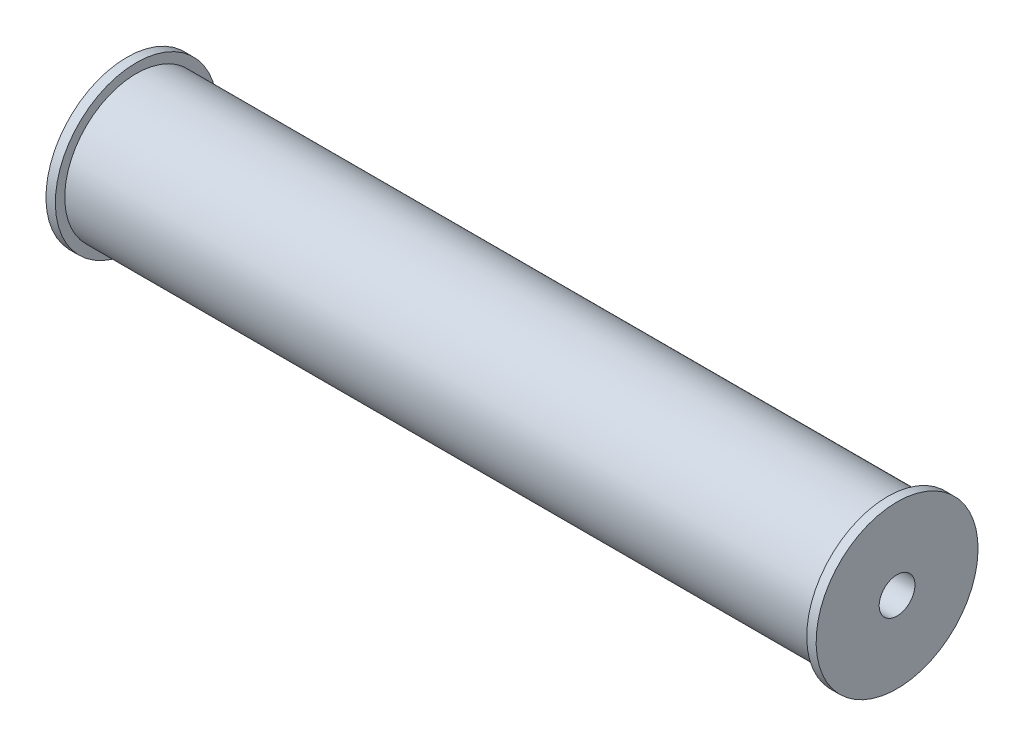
SolidWorks part; units mm, degrees
ref_plane "Front Plane" through (0, 0, 0) normal (0, 0, 1) x (1, 0, 0)
ref_plane "Top Plane" through (0, 0, 0) normal (0, 1, 0) x (1, 0, 0)
ref_plane "Right Plane" through (0, 0, 0) normal (1, 0, 0) x (0, 0, -1)
sketch "Sketch1" plane through (3359.6119, -126.9991, 62.9707) normal (-1, 0, 0) x (0, 0, -1)
  circle A0 centre (1.8793, 46.4927) radius 4.445 construction
  circle A1 centre (1.8793, 46.4927) radius 4.445 construction
  circle A2 centre (1.8793, 46.4927) radius 19.05
  circle A3 centre (1.8793, 46.4927) radius 4.7625
  dimension "D1" = 38.1
  dimension "D2" = 9.525
extrude "Boss-Extrude1" add sketch "Sketch1" along normal blind 205 contours A2 | A3
sketch "Sketch2" plane through (3359.6119, 0, 0) normal (1, 0, 0) x (0, 0, -1)
  circle A0 centre (-61.0914, -173.4918) radius 19.05 construction
  circle A1 centre (-61.0914, -173.4918) radius 19.05
  circle A2 centre (-61.0914, -173.4918) radius 21.55
  dimension "D1" = 2.5
extrude "Boss-Extrude2" add sketch "Sketch2" against normal blind 2.5
ref_plane "Plane1" through (3257.1119, 0, 0) normal (1, 0, 0) x (0, 0, -1)
mirror "Mirror1" about plane through (3257.1119, 0, 0) normal (1, 0, 0) of "Boss-Extrude2"
